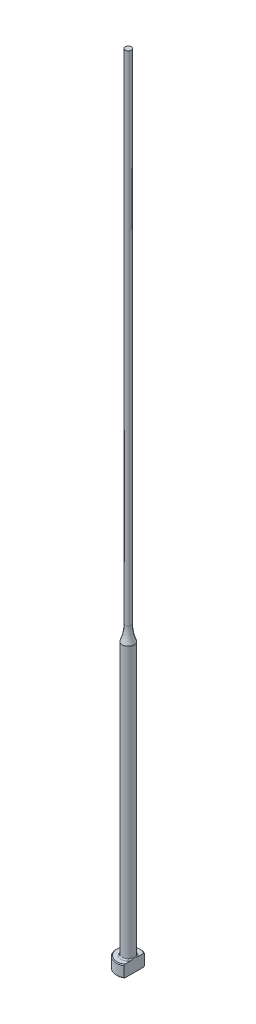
SolidWorks part; units mm, degrees
ref_plane "Front Plane" through (0, 0, 0) normal (0, 0, 1) x (1, 0, 0)
ref_plane "Top Plane" through (0, 0, 0) normal (0, 1, 0) x (1, 0, 0)
ref_plane "Right Plane" through (0, 0, 0) normal (1, 0, 0) x (0, 0, -1)
sketch "Sketch1" plane through (0, 0, 0) normal (0, 0, 1) x (1, 0, 0)
  line L0 (0, 259.9588) -> (0, -15.1925) construction
  line L1 (0, 0) -> (-3, 0)
  line L2 (-3, 0) -> (-3, 3)
  line L3 (-3, 3) -> (-1.5, 3)
  line L4 (-0.75, 75) -> (-0.75, 200)
  line L5 (-0.75, 200) -> (0, 200)
  line L6 (0, 200) -> (0, 0)
  line L7 (-1.5, 3) -> (-1.5, 71.2003)
  arc A0 (-1.5, 71.2003) -> (-0.75, 75) centre (-10.75, 75) ccw
  point P13 (-1.5, 0)
  dimension "D1" = 10
  dimension "L" = 200
  dimension "H" = 6
  dimension "T" = 3
  dimension "D" = 1.5
  dimension "B" = 3
  dimension "S" = 75
revolve "Revolve1" add sketch "Sketch1" angle 360 about L0
chamfer "Chamfer1" distance 0.2 angle 45 2 edges at (0, 3, 3) (0, 0, 3)
fillet "Fillet1" radius 0.3 1 edges at (0, 3, 1.5)
sketch "Sketch2" plane through (0, 0, 0) normal (0, 1, 0) x (1, 0, 0)
  line L0 (1.5, 2.5981) -> (1.5, -2.5981)
  circle A0 centre (0, 0) radius 3 construction
  arc A1 (1.5, -2.5981) -> (1.5, 2.5981) centre (0, 0) ccw
  circle A2 centre (0, 0) radius 1.5 construction
extrude "KEY" cut sketch "Sketch2" along normal through all
